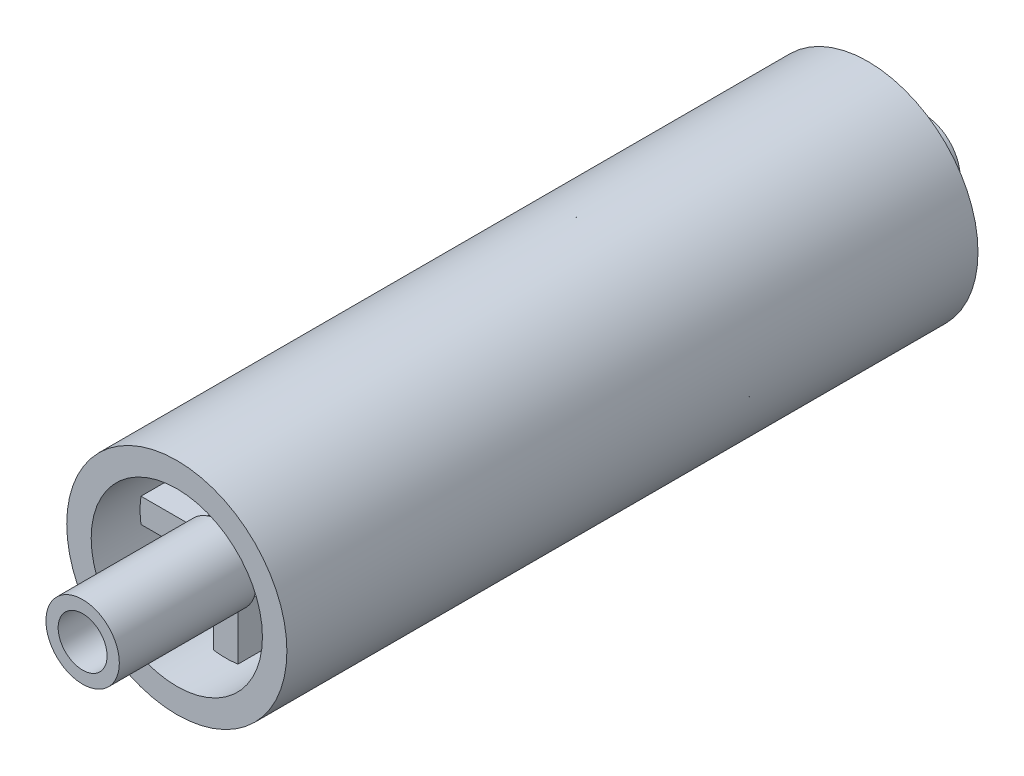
SolidWorks part; units mm, degrees
ref_plane "Plan de face" through (0, 0, 0) normal (0, 0, 1) x (1, 0, 0)
ref_plane "Plan de dessus" through (0, 0, 0) normal (0, 1, 0) x (1, 0, 0)
ref_plane "Plan de droite" through (0, 0, 0) normal (1, 0, 0) x (0, 0, -1)
sketch "Esquisse1" plane through (0, 0, 0) normal (0, 0, 1) x (1, 0, 0)
  circle A0 centre (0, 0) radius 9
  circle A1 centre (0, 0) radius 7
  dimension "D1" = 18
  dimension "D2" = 14
extrude "Extrusion1" add sketch "Esquisse1" along normal mid plane 68.5
sketch "Esquisse2" plane through (0, 0, 0) normal (0, 0, 1) x (1, 0, 0)
  line L0 (-8.1239, 1) -> (-1, 1)
  line L1 (1, 1) -> (7.6537, 1)
  line L2 (-1, 7.5382) -> (-1, 1)
  line L3 (1, -1) -> (7.6537, -1)
  line L4 (1, 7.5382) -> (1, 1)
  line L5 (-8.1239, -1) -> (-1, -1)
  line L6 (-8.1239, 1) -> (-8.1239, -1)
  line L7 (7.6537, 1) -> (7.6537, -1)
  line L8 (-1, 7.5382) -> (1, 7.5382)
  line L9 (-1, -1) -> (-1, -8.0779)
  line L10 (-1, -8.0779) -> (1, -8.0779)
  line L11 (1, -1) -> (1, -8.0779)
  dimension "D1" = 2
  dimension "D2" = 1
  dimension "D3" = 1
  dimension "D4" = 2
extrude "Extrusion2" add sketch "Esquisse2" along normal mid plane 48.5
sketch "Esquisse3" plane through (0, 0, 0) normal (0, 0, 1) x (1, 0, 0)
  circle A0 centre (0, 0) radius 3
  dimension "D1" = 6
extrude "Enlèv. mat.-Extru.1" cut sketch "Esquisse3" against normal through all and the other way through all
sketch "Esquisse4" plane through (0, 0, 34.25) normal (0, 0, 1) x (1, 0, 0)
  circle A0 centre (0, 0) radius 3
  circle A1 centre (0, 0) radius 2
  dimension "D1" = 6
  dimension "D2" = 4
extrude "Extrusion3" add sketch "Esquisse4" against normal blind 9.5
sketch "Esquisse5" plane through (0, 0, -34.25) normal (0, 0, -1) x (-1, 0, 0)
  line L0 (-1.3229, 1.5) -> (1.3229, 1.5)
  line L1 (-1.3229, -1.5) -> (1.3229, -1.5)
  circle A0 centre (0, 0) radius 3
  arc A1 (-1.3229, 1.5) -> (-1.3229, -1.5) centre (0, 0) ccw
  arc A2 (1.3229, -1.5) -> (1.3229, 1.5) centre (0, 0) ccw
  dimension "D1" = 6
  dimension "D2" = 4
  dimension "D3" = 3
  dimension "D4" = 1.5
extrude "Extrusion4" add sketch "Esquisse5" against normal blind 8.55
sketch "Esquisse6" plane through (0, 0, -34.25) normal (0, 0, -1) x (-1, 0, 0)
  circle A0 centre (0, 0) radius 3
extrude "Enlèv. mat.-Extru.2" cut sketch "Esquisse6" against normal blind 6 flip side to cut
sketch "Esquisse7" plane through (0, 0, 34.25) normal (0, 0, 1) x (1, 0, 0)
  circle A0 centre (0, 0) radius 3
  dimension "D1" = 6
extrude "Enlèv. mat.-Extru.4" cut sketch "Esquisse7" against normal blind 6 flip side to cut
sketch "Esquisse8" plane through (0, 0, -34.25) normal (0, 0, -1) x (-1, 0, 0)
  circle A0 centre (0, 0) radius 3
  dimension "D1" = 6
extrude "Enlèv. mat.-Extru.5" cut sketch "Esquisse8" against normal blind 1.45
sketch "Esquisse9" plane through (0, 0, 34.25) normal (0, 0, 1) x (1, 0, 0)
  circle A0 centre (0, 0) radius 2
  circle A1 centre (0, 0) radius 3
  dimension "D1" = 6
  dimension "D2" = 4
extrude "Extrusion5" add sketch "Esquisse9" along normal blind 1.7
